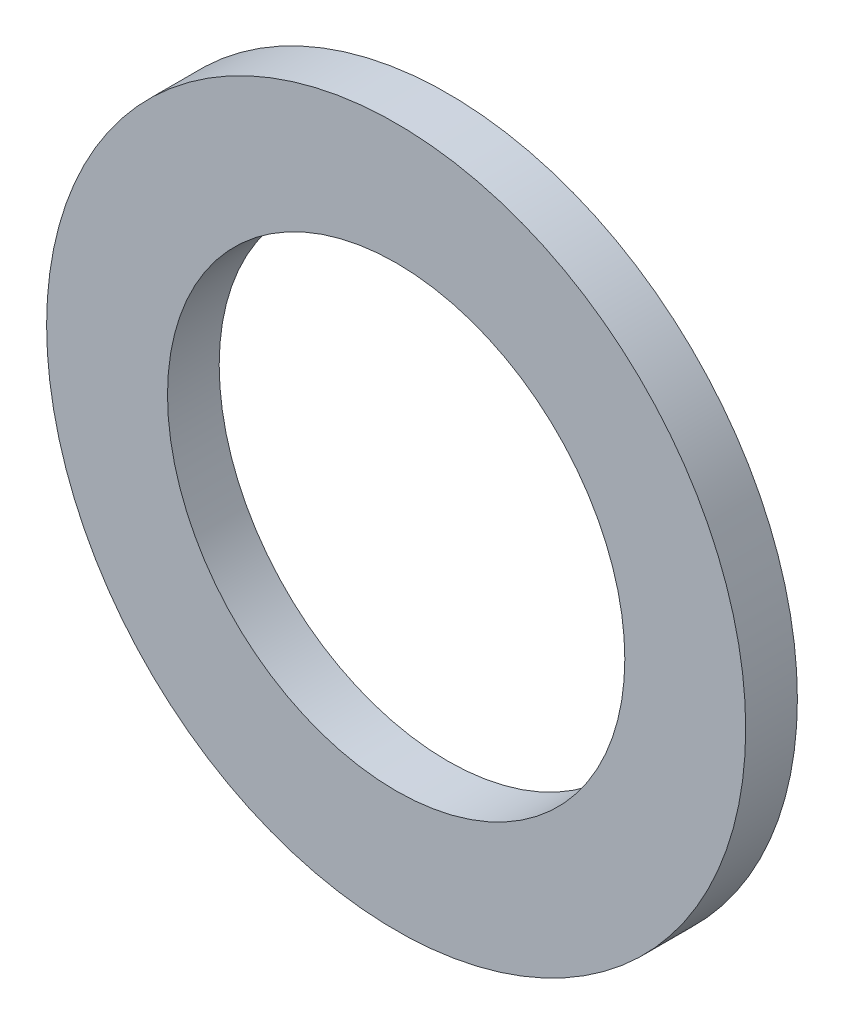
SolidWorks part; units mm, degrees
ref_plane "Front Plane" through (0, 0, 0) normal (0, 0, 1) x (1, 0, 0)
ref_plane "Top Plane" through (0, 0, 0) normal (0, 1, 0) x (1, 0, 0)
ref_plane "Right Plane" through (0, 0, 0) normal (1, 0, 0) x (0, 0, -1)
sketch "Sketch1" plane through (0, 0, 0) normal (0, 0, 1) x (1, 0, 0)
  circle A0 centre (9.4685, -4.905) radius 6.7437
  circle A1 centre (9.4685, -4.905) radius 10.309
extrude "Boss-Extrude1" add sketch "Sketch1" along normal blind 1.524
